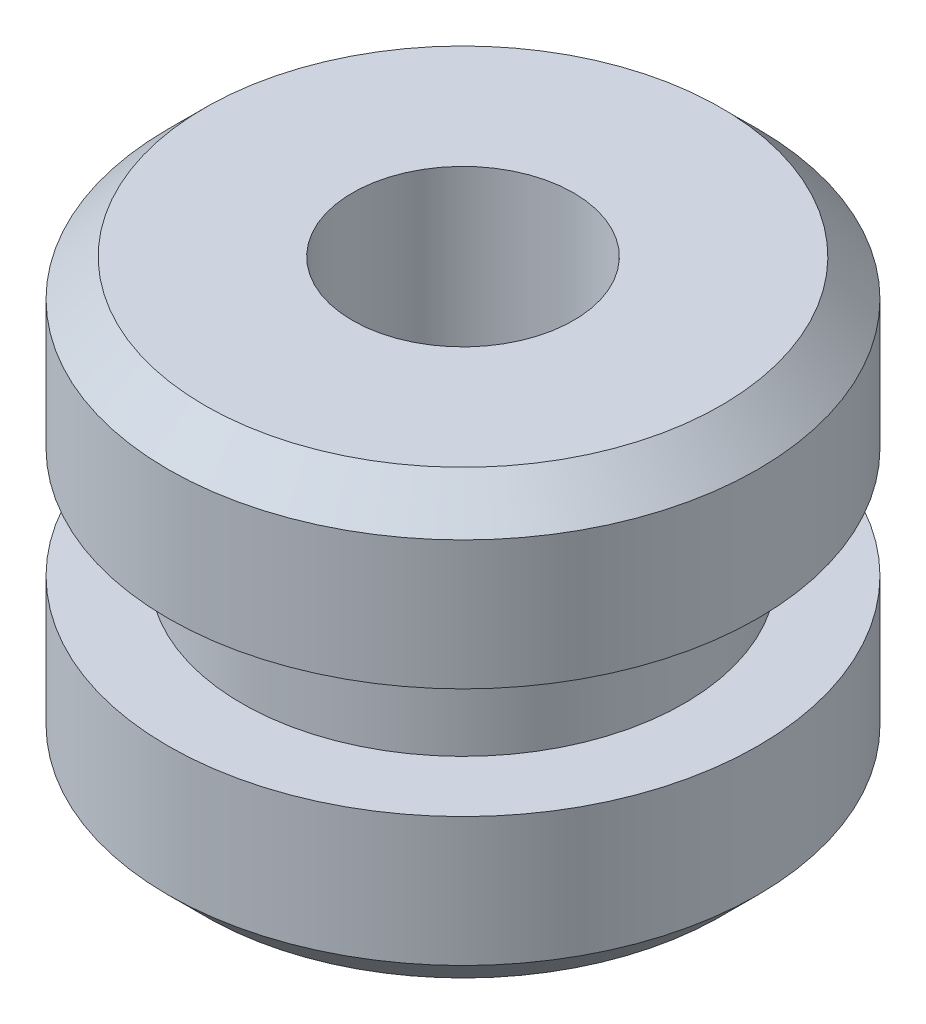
SolidWorks part; units mm, degrees
ref_plane "Plan1" through (0, 0, 0) normal (0, 0, 1) x (1, 0, 0)
ref_plane "Plan2" through (0, 0, 0) normal (0, 1, 0) x (1, 0, 0)
ref_plane "Plan3" through (0, 0, 0) normal (1, 0, 0) x (0, 0, -1)
sketch "Esquisse1" plane through (0, 0, 0) normal (0, 0, 1) x (1, 0, 0)
  line L0 (0, -8) -> (0, 21) construction
  line L1 (1.5, 6) -> (1.5, 0)
  line L2 (1.5, 6) -> (4, 6)
  line L3 (4, 6) -> (4, 3.75)
  line L4 (4, 3.75) -> (3, 3.75)
  line L5 (3, 3.75) -> (3, 2.25)
  line L6 (3, 2.25) -> (4, 2.25)
  line L7 (4, 2.25) -> (4, 0)
  line L8 (4, 0) -> (1.5, 0)
  dimension "D1" = 3
  dimension "D2" = 8
  dimension "D3" = 6
  dimension "D4" = 6
  dimension "D5" = 1.5
revolve "Base-Révolution" add sketch "Esquisse1" angle 360 about L0
chamfer "Chanfrein1" distance 0.5 angle 45
